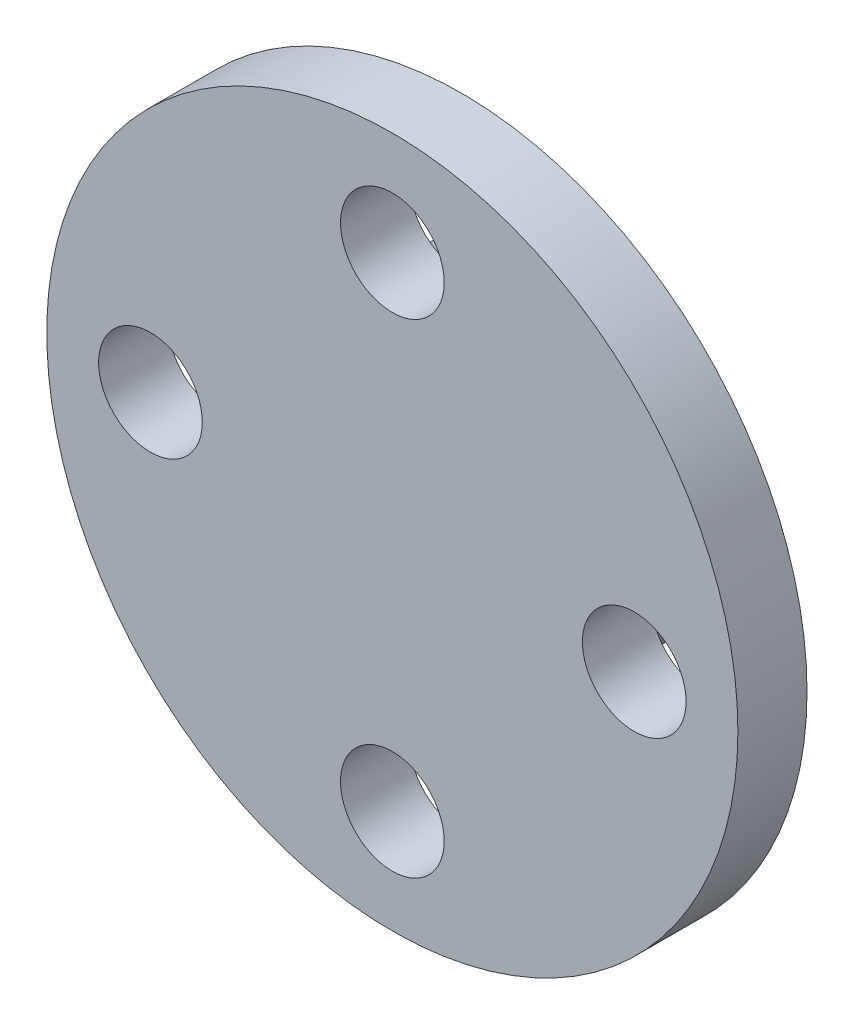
SolidWorks part; units mm, degrees
ref_plane "前视基准面" through (0, 0, 0) normal (0, 0, 1) x (1, 0, 0)
ref_plane "上视基准面" through (0, 0, 0) normal (0, 1, 0) x (1, 0, 0)
ref_plane "右视基准面" through (0, 0, 0) normal (1, 0, 0) x (0, 0, -1)
sketch "草图1" plane through (0, 0, 0) normal (0, 0, 1) x (1, 0, 0)
  circle A0 centre (0, 0) radius 4.75
extrude "凸台-拉伸1" add sketch "草图1" along normal blind 3.6
sketch "草图2" plane through (0, 0, 3.6) normal (0, 0, 1) x (1, 0, 0)
  line L0 (0, 0) -> (0, 7)
  circle A0 centre (0, 0) radius 10
  circle A1 centre (0, 7) radius 1.5
  circle A2 centre (7, 0) radius 1.5
  circle A3 centre (0, -7) radius 1.5
  circle A4 centre (-7, 0) radius 1.5
  point P14 (0, 0)
  dimension "D1" = 4
extrude "凸台-拉伸2" add sketch "草图2" along normal blind 2
